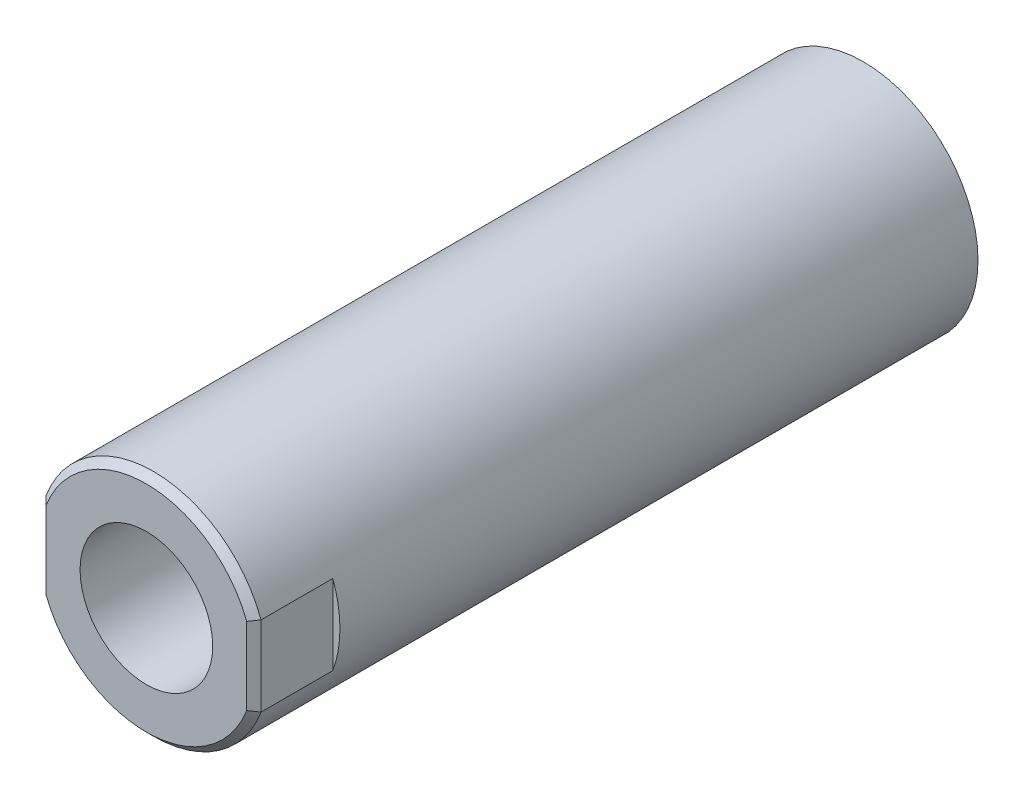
SolidWorks part; units mm, degrees
ref_plane "Front Plane" through (0, 0, 0) normal (0, 0, 1) x (1, 0, 0)
ref_plane "Top Plane" through (0, 0, 0) normal (0, 1, 0) x (1, 0, 0)
ref_plane "Right Plane" through (0, 0, 0) normal (1, 0, 0) x (0, 0, -1)
sketch "Sketch1" plane through (0, 0, 0) normal (0, 0, 1) x (1, 0, 0)
  circle A0 centre (0, 0) radius 16
  dimension "D1" = 32
extrude "S" add sketch "Sketch1" against normal blind 100
sketch "Sketch2" plane through (0, 0, 0) normal (0, 0, 1) x (1, 0, 0)
  circle A0 centre (0, 0) radius 16
  circle A1 centre (0, 0) radius 16 construction
  dimension "D1" = 32
extrude "L2" add sketch "Sketch2" along normal blind 14
hole_wizard "( T1xL4 ) M16x1.25 Tapped Hole1 " positions "3DSketch1" profile "Sketch5" tap size "M20x1.5" standard "Ansi Metric"
sketch3d "3DSketch1"
  circle A0 centre (0, 0, 14) radius 16 construction
  point P0 (0, 0, 14)
  point P5 (0, 0, 30)
sketch "Sketch5" plane through (0, 0, 14) normal (1, 0, 0) x (0, -1, 0)
  line L0 (0, 0) -> (0, 35.058)
  line L1 (0, 35.058) -> (9.25, 29.5)
  line L2 (9.25, 29.5) -> (9.25, 0)
  line L5 (9.25, 0) -> (0, 0)
  line L10 (0, 35.058) -> (-9.25, 29.5) construction
  line L11 (0, -6.35) -> (0, 107.95) construction
  dimension "Tap Drill Dia." = 18.5
  dimension "Tap Drill Depth" = 29.5
  dimension "Drill Angle" = 118
chamfer "Chamfer2" distance 0.5 angle 45 1 edges at (16, 0, 14)
sketch "Sketch6" plane through (0, 0, 0) normal (0, 0, 1) x (1, 0, 0)
  circle A0 centre (0, 0) radius 15.5
  circle A1 centre (0, 0) radius 16
  circle A2 centre (0, 0) radius 16 construction
  circle A4 centre (0, 0) radius 16 construction
  dimension "D1" = 32
  dimension "D2" = 31
  dimension "D3" = 32
extrude "U/C" cut sketch "Sketch6" along normal blind 1
sketch "Sketch7" plane through (0, 0, 0) normal (0, 1, 0) x (1, 0, 0)
  line L1 (15, 0) -> (17.5, 0)
  line L2 (15, 0) -> (15, 11)
  line L3 (15, 11) -> (17.5, 11)
  line L4 (17.5, 0) -> (17.5, 11)
  line L5 (-17.5, 0) -> (-15, 0)
  line L6 (-17.5, 0) -> (-17.5, 11)
  line L7 (-17.5, 11) -> (-15, 11)
  line L8 (-15, 0) -> (-15, 11)
  line L12 (0, -1) -> (0, -13.5) construction
  line L13 (-16, 100) -> (16, 100) construction
  line L14 (0, 0) -> (0, -14) construction
  line L15 (0, 15.5) -> (0, -14) construction
  line L16 (-15.5, -14) -> (15.5, -14) construction
  dimension "D1" = 11
  dimension "D2" = 30
  dimension "D3" = 15
  dimension "D4" = 35
  dimension "D5" = 17.5
  dimension "D6" = 32
  dimension "D7" = 14
extrude "A/F" cut sketch "Sketch7" against normal mid plane 21
sketch "Sketch8" plane through (0, 0, 0) normal (0, 1, 0) x (1, 0, 0)
  line L1 (-25.4483, 0) -> (24.9987, 0)
  line L2 (-25.4483, 0) -> (-25.4483, -16.8789)
  line L3 (-25.4483, -16.8789) -> (24.9987, -16.8789)
  line L4 (24.9987, 0) -> (24.9987, -16.8789)
extrude "Cut-Extrude1" cut sketch "Sketch8" against normal mid plane 50
chamfer "Chamfer3" distance 1 angle 45 4 edges at (-15, 0, 0) (0, 16, 0) (0, -16, 0) (15, 0, 0)
equation "\"D2@Sketch6\" =\"D3@Sketch6\" - 1"
equation "\"D1@Sketch6\" = \"D3@Sketch6\""
equation "\"D2@Sketch7\" = \"D6@Sketch7\" - 2"
equation "\"D3@Sketch7\" = \"D2@Sketch7\" / 2"
equation "\"D4@Sketch7\" = \"D2@Sketch7\"+5"
equation "\"D5@Sketch7\" = \"D4@Sketch7\"/2"
equation "\"D1@Sketch7\" = \"D7@Sketch7\"-3"
